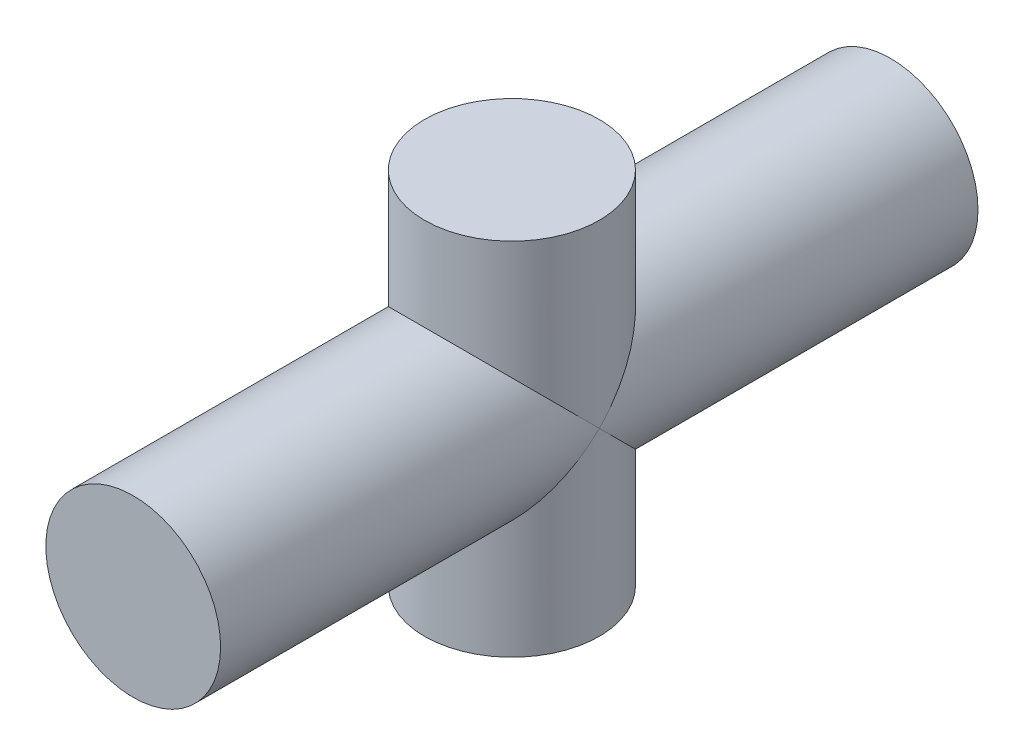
SolidWorks part; units mm, degrees
ref_plane "Plan de face" through (0, 0, 0) normal (0, 0, 1) x (1, 0, 0)
ref_plane "Plan de dessus" through (0, 0, 0) normal (0, 1, 0) x (1, 0, 0)
ref_plane "Plan de droite" through (0, 0, 0) normal (1, 0, 0) x (0, 0, -1)
sketch "Esquisse1" plane through (0, 0, 0) normal (0, 1, 0) x (1, 0, 0)
  circle A0 centre (0, 0) radius 15
  dimension "D1" = 30
extrude "Extrusion1" add sketch "Esquisse1" along normal blind 61.85
sketch "Esquisse2" plane through (0, 0, 0) normal (0, 0, 1) x (1, 0, 0)
  line L0 (-15, 30.925) -> (15, 30.925) construction
  line L1 (-15, 61.85) -> (-15, 0) construction
  line L2 (15, 0) -> (15, 61.85) construction
  circle A0 centre (0, 30.925) radius 15
  dimension "D1" = 30
extrude "Extrusion2" add sketch "Esquisse2" along normal mid plane 130
